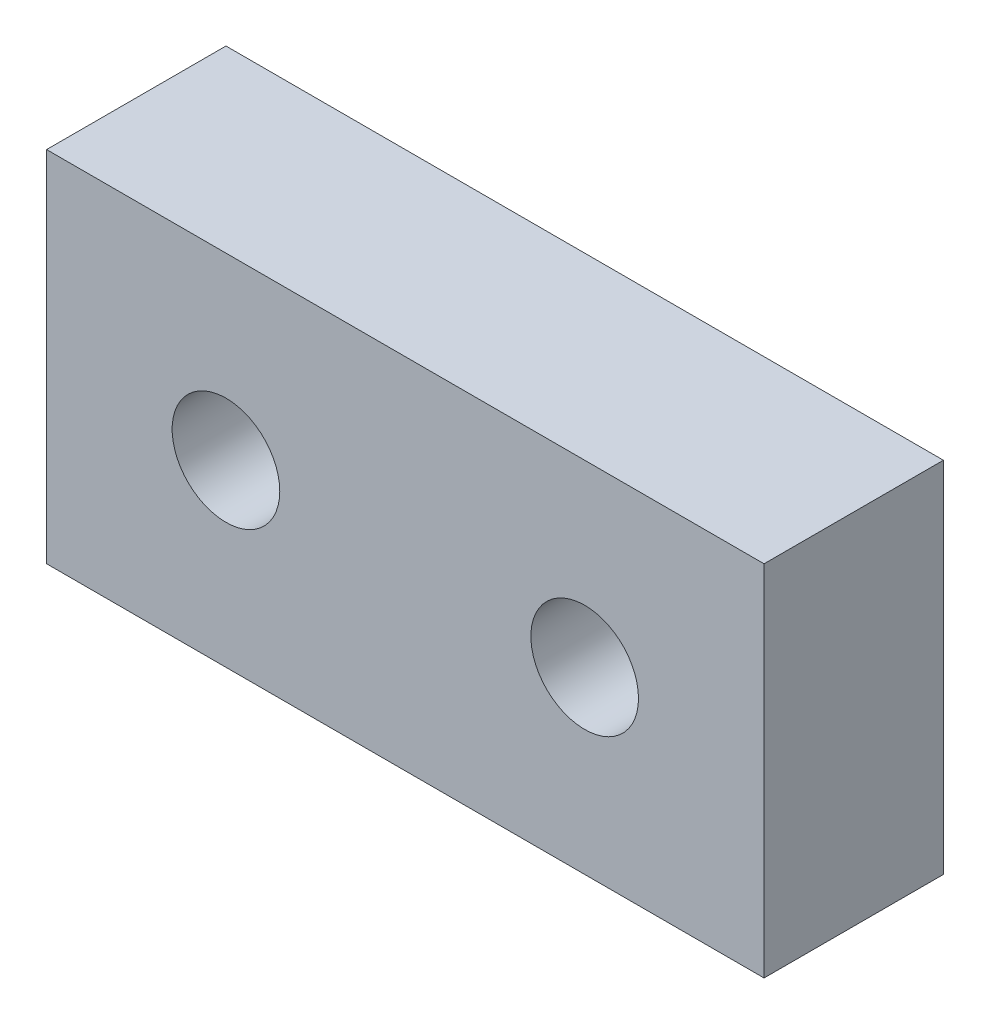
SolidWorks part; units mm, degrees
ref_plane "Ebene1" through (0, 0, 0) normal (0, 0, 1) x (1, 0, 0)
ref_plane "Ebene2" through (0, 0, 0) normal (0, 1, 0) x (1, 0, 0)
ref_plane "Ebene3" through (0, 0, 0) normal (1, 0, 0) x (0, 0, -1)
sketch "Skizze1" plane through (0, 0, 0) normal (0, 0, 1) x (1, 0, 0)
  line L0 (0, 50) -> (0, -50) construction
  line L1 (-100, 50) -> (100, 50)
  line L2 (-100, 50) -> (-100, -50)
  line L3 (-100, -50) -> (100, -50)
  line L4 (100, 50) -> (100, -50)
  dimension "D1" = 200
  dimension "D2" = 100
extrude "Basis-Linear austragen" add sketch "Skizze1" along normal blind 50
sketch "Skizze2" plane through (0, 0, 50) normal (0, 0, 1) x (1, 0, 0)
  line L0 (0, 0) -> (0, 33.8834) construction
  circle A0 centre (-50, 0) radius 15
  circle A1 centre (50, 0) radius 15
  dimension "D1" = 30
  dimension "D2" = 100
extrude "Schnitt-Linear austragen1" cut sketch "Skizze2" against normal through all
